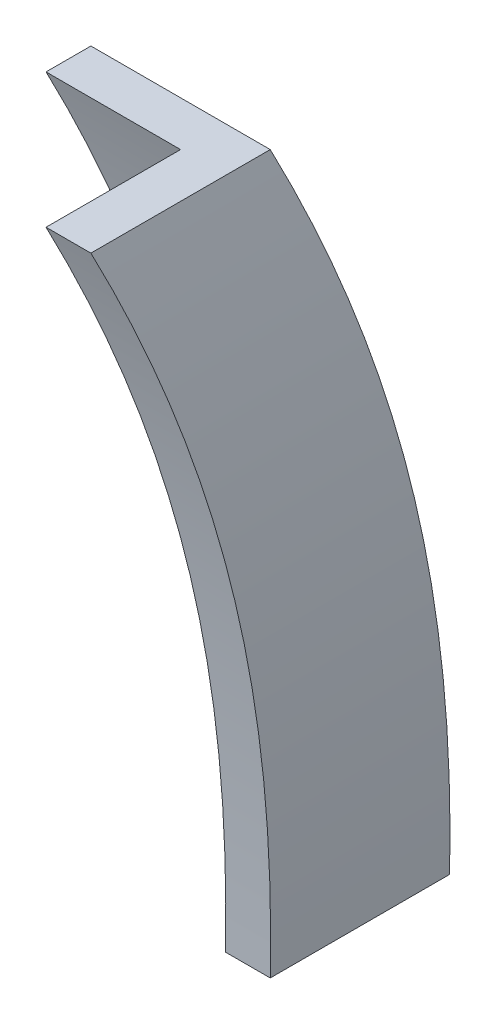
SolidWorks part; units mm, degrees
ref_plane "Front Plane" through (0, 0, 0) normal (0, 0, 1) x (1, 0, 0)
ref_plane "Top Plane" through (0, 0, 0) normal (0, 1, 0) x (1, 0, 0)
ref_plane "Right Plane" through (0, 0, 0) normal (1, 0, 0) x (0, 0, -1)
sketch "Sketch2" plane through (0, 0, 0) normal (0, 1, 0) x (1, 0, 0)
  line L1 (-6.35, 6.35) -> (6.35, 6.35)
  line L2 (-6.35, 6.35) -> (-6.35, 3.175)
  line L3 (3.175, -6.35) -> (6.35, -6.35)
  line L4 (6.35, 6.35) -> (6.35, -6.35)
  line L9 (-6.35, 3.175) -> (3.175, 3.175)
  line L10 (3.175, -6.35) -> (3.175, 3.175)
  dimension "D1" = 12.7
  dimension "D2" = 3.175
  dimension "D3" = 3.175
  dimension "D4" = 12.7
ref_plane "Plane1" through (0, 44.45, 0) normal (0, 1, 0) x (1, 0, 0)
sketch "Sketch4" plane through (0, 44.45, 0) normal (0, 1, 0) x (1, 0, 0)
  line L1 (0, 0) -> (-12.7, 0)
  line L2 (0, 0) -> (0, -12.7)
  line L3 (0, -12.7) -> (-3.175, -12.7)
  line L4 (-12.7, 0) -> (-12.7, -3.175)
  line L9 (-12.7, -3.175) -> (-3.175, -3.175)
  line L10 (-3.175, -12.7) -> (-3.175, -3.175)
  dimension "D1" = 3.175
  dimension "D2" = 12.7
  dimension "D3" = 3.175
  dimension "D4" = 12.7
sketch3d "3DSketch3"
  spline S0 degree 3 poles (6.35, 0, -6.35) (6.8678, 15.9952, -6.1622) (5.7642, 30.5222, -4.5195) (0, 44.45, 0) knots 0 0 0 0 1 1 1 1
loft "Loft2" add profiles "Sketch4", "Sketch2"
